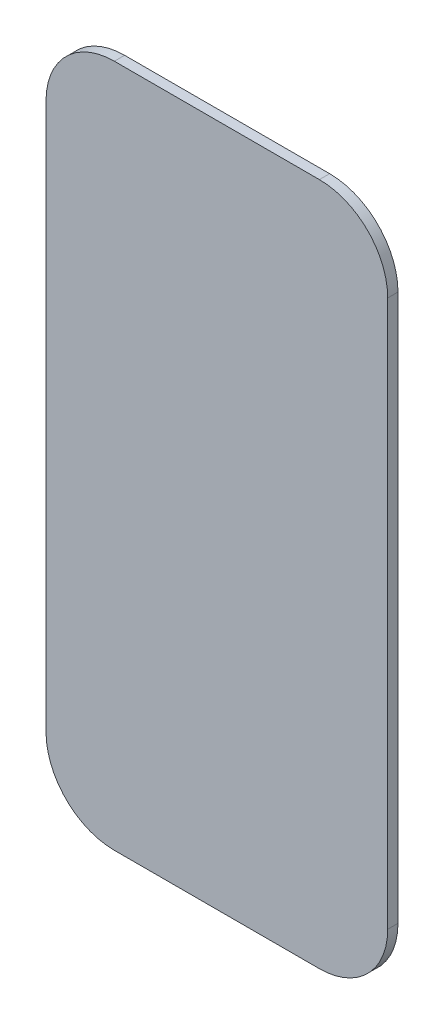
SolidWorks part; units mm, degrees
ref_plane "Front Plane" through (0, 0, 0) normal (0, 0, 1) x (1, 0, 0)
ref_plane "Top Plane" through (0, 0, 0) normal (0, 1, 0) x (1, 0, 0)
ref_plane "Right Plane" through (0, 0, 0) normal (1, 0, 0) x (0, 0, -1)
sketch "Sketch1" plane through (0, 0, 0) normal (0, 0, 1) x (1, 0, 0)
  line L1 (30, -100) -> (-30, -100)
  line L2 (50, -80) -> (50, 80)
  line L3 (30, 100) -> (-30, 100)
  line L4 (-50, -80) -> (-50, 80)
  line L5 (50, -100) -> (-50, 100) construction
  line L6 (50, 100) -> (-50, -100) construction
  arc A0 (-30, -100) -> (-50, -80) centre (-30, -80) cw
  arc A1 (30, -100) -> (50, -80) centre (30, -80) ccw
  arc A2 (50, 80) -> (30, 100) centre (30, 80) ccw
  arc A3 (-30, 100) -> (-50, 80) centre (-30, 80) ccw
  point P0 (0, 0)
  dimension "D1" = 20
  dimension "ancho" = 100
  dimension "alto" = 200
extrude "Boss-Extrude1" add sketch "Sketch1" along normal blind 3
